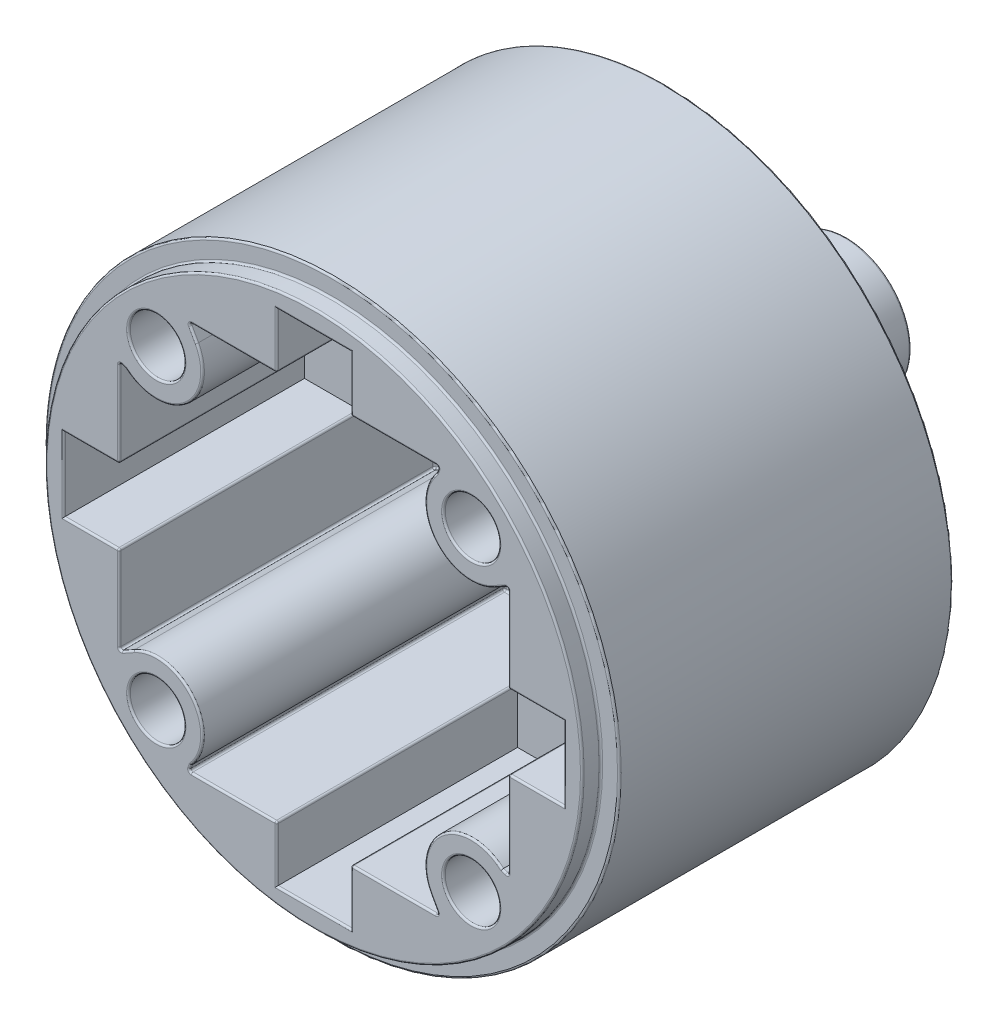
SolidWorks part; units mm, degrees
ref_plane "Plan1" through (0, 0, 0) normal (0, 0, 1) x (1, 0, 0)
ref_plane "Plan2" through (0, 0, 0) normal (0, 1, 0) x (1, 0, 0)
ref_plane "Plan3" through (0, 0, 0) normal (1, 0, 0) x (0, 0, -1)
sketch "Esquisse1" plane through (0, 0, 0) normal (0, 0, 1) x (1, 0, 0)
  circle A0 centre (0, 0) radius 15.5
  dimension "D1" = 31
extrude "Extrusion1" add sketch "Esquisse1" along normal blind 18
sketch "Esquisse2" plane through (0, 0, 18) normal (0, 0, 1) x (1, 0, 0)
  circle A0 centre (0, 0) radius 14.5
  dimension "D1" = 29
extrude "Extrusion2" add sketch "Esquisse2" along normal blind 1
sketch "Esquisse3" plane through (0, 0, 19) normal (0, 0, 1) x (1, 0, 0)
  line L1 (-7.5, 10.5) -> (7.5, 10.5)
  line L2 (-10.5, 7.5) -> (-10.5, -7.5)
  line L3 (-7.5, -10.5) -> (7.5, -10.5)
  line L4 (10.5, 7.5) -> (10.5, -7.5)
  arc A0 (7.5, 10.5) -> (10.5, 7.5) centre (7.5, 7.5) cw
  arc A1 (-10.5, 7.5) -> (-7.5, 10.5) centre (-7.5, 7.5) cw
  arc A2 (-7.5, -10.5) -> (-10.5, -7.5) centre (-7.5, -7.5) cw
  arc A3 (10.5, -7.5) -> (7.5, -10.5) centre (7.5, -7.5) cw
  dimension "D5" = 3
  dimension "D1" = 10.5
  dimension "D2" = 10.5
  dimension "D3" = 10.5
  dimension "D4" = 10.5
extrude "Enlèv. mat.-Extru.1" cut sketch "Esquisse3" against normal blind 17
sketch "Esquisse4" plane through (0, 0, 19) normal (0, 0, 1) x (1, 0, 0)
  line L0 (9.7152, 6.3152) -> (10.5, 6.7517)
  line L1 (7.5, 10.5) -> (-7.5, 10.5) construction
  line L2 (10.5, -7.5) -> (10.5, 7.5) construction
  line L3 (7.5, 10.5) -> (6.7517, 10.5)
  line L4 (10.5, 6.7517) -> (10.5, 7.5)
  line L5 (0, 0) -> (8.5, 8.5) construction
  line L6 (6.6253, 10.1539) -> (6.7517, 10.5)
  arc A0 (6.6253, 10.1539) -> (9.7152, 6.3152) centre (8.5, 8.5) ccw
  arc A1 (10.5, 7.5) -> (7.5, 10.5) centre (7.5, 7.5) ccw construction
  arc A2 (10.5, 7.5) -> (7.5, 10.5) centre (7.5, 7.5) ccw
  dimension "D1" = 5
  dimension "D2" = 8.5
  dimension "D3" = 8.5
extrude "Extrusion3" add sketch "Esquisse4" against normal up to surface (17 mm away)
hole_wizard "Trou taraudé M3x0.51" positions "Esquisse7" profile "Esquisse6" tap size "M3x0.5" standard "ISO"
sketch "Esquisse7" plane through (0, 0, 19) normal (0, 0, 1) x (1, 0, 0)
  arc A0 (6.6253, 10.1539) -> (9.7152, 6.3152) centre (8.5, 8.5) ccw construction
  point P0 (8.5, 8.5)
sketch "Esquisse6" plane through (8.5, 8.5, 19) normal (1, 0, 0) x (0, -1, 0)
  line L0 (0, 0) -> (0, 9.2511)
  line L1 (0, 9.2511) -> (1.25, 8.5)
  line L2 (1.25, 8.5) -> (1.25, 6)
  line L3 (1.25, 6) -> (1.5, 6)
  line L4 (1.5, 6) -> (1.5, 0)
  line L5 (1.5, 0) -> (0, 0)
  line L10 (0, 9.2511) -> (-1.25, 8.5) construction
  line L11 (0, -6.35) -> (0, 107.95) construction
  dimension "Diamètre du trou pour taraudage" = 2.5
  dimension "Profondeur du trou pour taraudage" = 8.5
  dimension "Diamètre principal du filetage" = 3
  dimension "Profondeur du filetage" = 6
  dimension "Angle de pointe" = 118
sketch "Esquisse8" plane through (0, 0, 19) normal (0, 0, 1) x (1, 0, 0)
  line L0 (0, 0) -> (18.9536, 0) construction
  line L1 (10.139, 2) -> (13.5, 2)
  line L2 (10.139, -2) -> (13.5, -2)
  line L3 (10.5, -7.5) -> (10.5, 6.7517) construction
  line L4 (13.5, 2) -> (13.5, 0)
  line L5 (13.5, 0) -> (13.5, -2)
  line L6 (10.139, -2) -> (10.139, 2)
  dimension "D1" = 4
  dimension "D2" = 3
extrude "Enlèv. mat.-Extru.2" cut sketch "Esquisse8" against normal blind 13
pattern_circular "Répétition circulaire1" count 4 over 360
sketch "Esquisse9" plane through (0, 0, 0) normal (0, 0, -1) x (-1, 0, 0)
  circle A0 centre (0, 0) radius 10
  dimension "D1" = 20
extrude "Extrusion4" add sketch "Esquisse9" along normal blind 3
sketch "Esquisse10" plane through (0, 0, -3) normal (0, 0, -1) x (-1, 0, 0)
  circle A0 centre (11.0981, 0) radius 1.7864
extrude "Enlèv. mat.-Extru.3" cut sketch "Esquisse10" against normal up to surface (3 mm away)
pattern_circular "Répétition circulaire2" count 4 over 360
sketch "Esquisse11" plane through (0, 0, -3) normal (0, 0, -1) x (-1, 0, 0)
  circle A0 centre (0, 0) radius 6.5
  dimension "D1" = 13
extrude "Extrusion5" add sketch "Esquisse11" along normal blind 0.75
sketch "Esquisse12" plane through (0, 0, -3.75) normal (0, 0, -1) x (-1, 0, 0)
  circle A0 centre (0, 0) radius 2.5
  dimension "D1" = 5
extrude "Enlèv. mat.-Extru.4" cut sketch "Esquisse12" against normal through all
sketch "Esquisse13" plane through (0, 0, 2) normal (0, 0, 1) x (1, 0, 0)
  circle A0 centre (0, 0) radius 3.5
  dimension "D1" = 7
extrude "Enlèv. mat.-Extru.5" cut sketch "Esquisse13" against normal blind 1
sketch "Esquisse14" plane through (0, 0, -3.75) normal (0, 0, -1) x (-1, 0, 0)
  circle A0 centre (0, 0) radius 2.5
  circle A1 centre (0, 0) radius 3.5
  dimension "D1" = 7
extrude "Extrusion6" add sketch "Esquisse14" along normal blind 6
fillet "Congé1" radius 0.1
sketch "Esquisse15" plane through (-10.5, 0, 0) normal (1, 0, 0) x (0, 0, -1)
  line L0 (0, 0) -> (-8.8498, 0) construction
  circle A0 centre (-3.5397, 0) radius 2
  dimension "D1" = 4
extrude "Enlèv. mat.-Extru.6" cut sketch "Esquisse15" against normal blind 10
fillet "Congé2" radius 0.1
